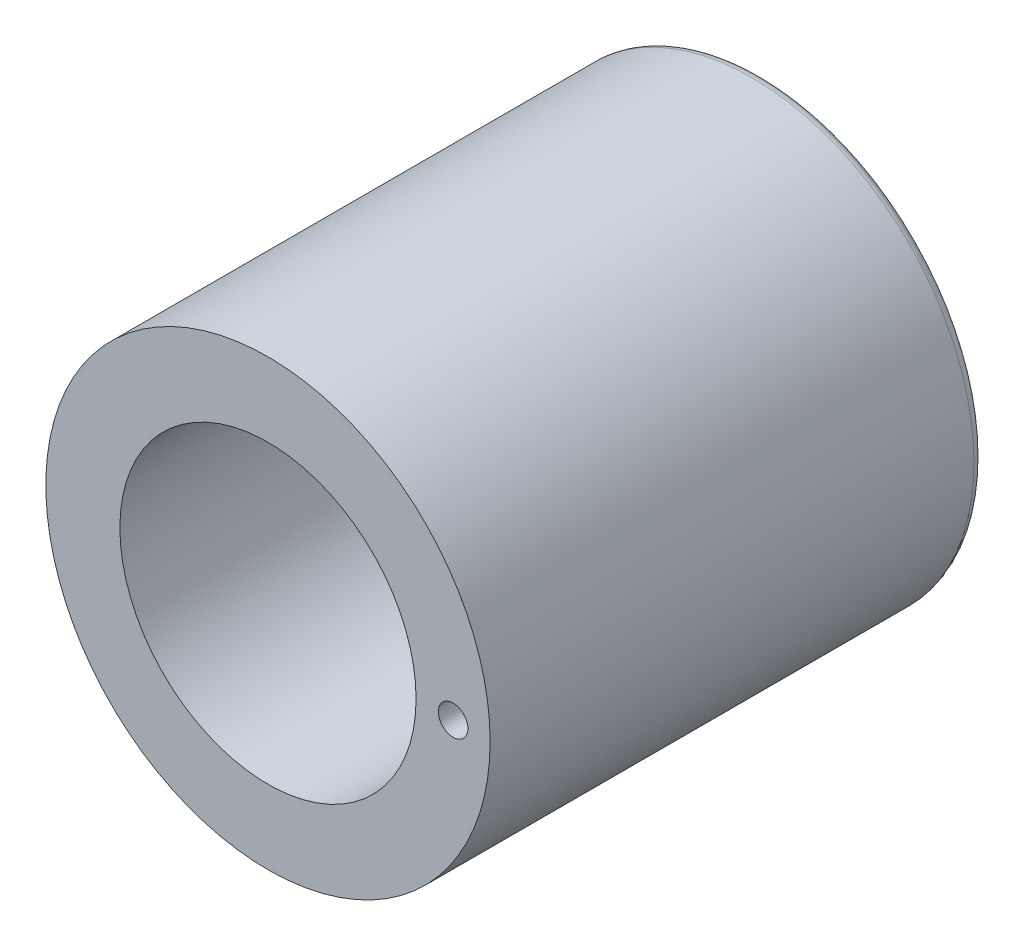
SolidWorks part; units mm, degrees
ref_plane "Plan1" through (0, 0, 0) normal (0, 0, 1) x (1, 0, 0)
ref_plane "Plan2" through (0, 0, 0) normal (0, 1, 0) x (1, 0, 0)
ref_plane "Plan3" through (0, 0, 0) normal (1, 0, 0) x (0, 0, -1)
sketch "Esquisse1" plane through (0, 0, 0) normal (0, 0, 1) x (1, 0, 0)
  circle A0 centre (0, 0) radius 45
extrude "Base-Extrusion" add sketch "Esquisse1" along normal blind 100
sketch "Esquisse2" plane through (0, 0, 100) normal (0, 0, 1) x (1, 0, 0)
  circle A0 centre (0, 0) radius 30
extrude "Enlèv. mat.-Extru.1" cut sketch "Esquisse2" against normal blind 100
sketch "Esquisse3" plane through (0, 0, 100) normal (0, 0, 1) x (1, 0, 0)
  circle A0 centre (37.5, 0) radius 3
extrude "Enlèv. mat.-Extru.2" cut sketch "Esquisse3" against normal blind 30
fillet "Congé1" radius 2
ref_plane "Plan4" through (0, 0, 51) normal (0, 0, -1) x (-1, 0, 0)
sketch "G1" plane through (0, 0, 51) normal (0, 0, -1) x (-1, 0, 0)
  point P0 (0, 0)
